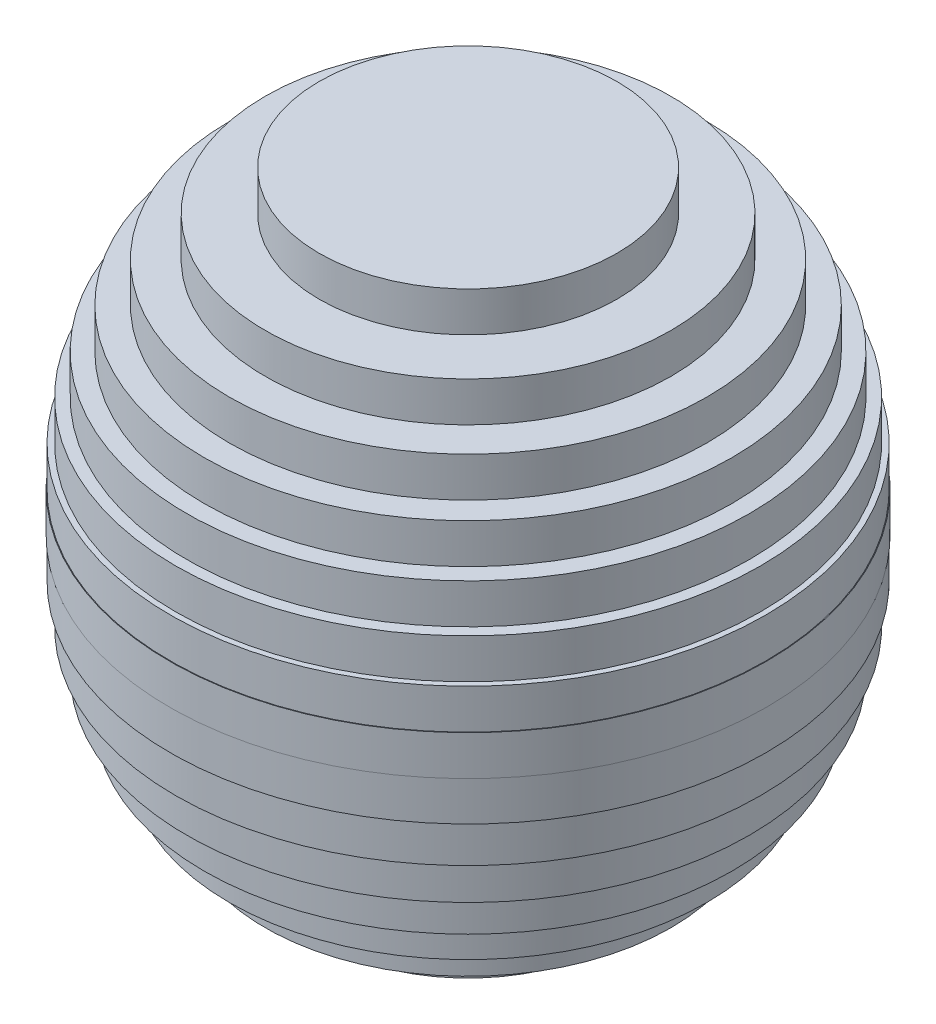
SolidWorks part; units mm, degrees
ref_plane "Front Plane" through (0, 0, 0) normal (0, 0, 1) x (1, 0, 0)
ref_plane "Top Plane" through (0, 0, 0) normal (0, 1, 0) x (1, 0, 0)
ref_plane "Right Plane" through (0, 0, 0) normal (1, 0, 0) x (0, 0, -1)
sketch "Sketch1" plane through (0, 0, 0) normal (0, 0, 1) x (1, 0, 0)
  line L0 (0, -37.5) -> (0, 37.5) construction
  line L1 (0, -37.5) -> (37.5, -37.5) construction
  line L2 (0, -32.5) -> (37.5, -32.5) construction
  line L3 (0, -27.5) -> (37.5, -27.5) construction
  line L4 (0, -22.5) -> (37.5, -22.5) construction
  line L5 (0, -17.5) -> (37.5, -17.5) construction
  line L6 (0, -12.5) -> (37.5, -12.5) construction
  line L7 (0, -7.5) -> (37.5, -7.5) construction
  line L35 (0, -2.5) -> (37.5, -2.5) construction
  line L36 (0, 2.5) -> (37.5, 2.5) construction
  line L37 (0, 7.5) -> (37.5, 7.5) construction
  line L38 (0, 12.5) -> (37.5, 12.5) construction
  line L39 (0, 17.5) -> (37.5, 17.5) construction
  line L40 (0, 22.5) -> (37.5, 22.5) construction
  line L41 (0, 27.5) -> (37.5, 27.5) construction
  line L42 (0, 32.5) -> (37.5, 32.5) construction
  arc A0 (0, 37.5) -> (0, -37.5) centre (0, 0) cw construction
  point P4 (0, 0)
  point P7 (37.5, 0)
  point P8 (0, 37.5)
sketch "Sketch3" plane through (0, 0, 0) normal (0, 0, 1) x (1, 0, 0)
  line L0 (37.5, 2.5) -> (37.5, -2.5)
  line L1 (37.5, -2.5) -> (37.4166, -2.5)
  line L2 (0, -2.5) -> (37.5, -2.5) construction
  line L3 (37.4166, -2.5) -> (37.4166, -7.5)
  line L4 (0, -7.5) -> (37.5, -7.5) construction
  line L5 (37.4166, -7.5) -> (36.7423, -7.5)
  line L6 (36.7423, -7.5) -> (36.7423, -12.5)
  line L7 (0, -12.5) -> (37.5, -12.5) construction
  line L8 (36.7423, -12.5) -> (35.3553, -12.5)
  line L9 (35.3553, -12.5) -> (35.3553, -17.5)
  line L10 (0, -17.5) -> (37.5, -17.5) construction
  line L11 (35.3553, -17.5) -> (33.1662, -17.5)
  line L12 (33.1662, -17.5) -> (33.1662, -22.5)
  line L13 (0, -22.5) -> (37.5, -22.5) construction
  line L14 (33.1662, -22.5) -> (30, -22.5)
  line L15 (30, -22.5) -> (30, -27.5)
  line L16 (0, -27.5) -> (37.5, -27.5) construction
  line L17 (30, -27.5) -> (25.4951, -27.5)
  line L18 (25.4951, -27.5) -> (25.4951, -32.5)
  line L19 (0, -32.5) -> (37.5, -32.5) construction
  line L20 (25.4951, -32.5) -> (18.7083, -32.5)
  line L21 (18.7083, -32.5) -> (18.7083, -37.5)
  line L22 (0, -37.5) -> (37.5, -37.5) construction
  line L23 (18.7083, -37.5) -> (0, -37.5)
  line L24 (0, -37.5) -> (0, 37.5)
  line L25 (18.7083, 32.5) -> (18.7083, 37.5)
  line L26 (0, 32.5) -> (37.5, 32.5) construction
  line L27 (18.7083, 37.5) -> (0, 37.5)
  line L28 (18.7083, 32.5) -> (25.4951, 32.5)
  line L29 (25.4951, 32.5) -> (25.4951, 27.5)
  line L30 (0, 27.5) -> (37.5, 27.5) construction
  line L31 (25.4951, 27.5) -> (30, 27.5)
  line L32 (30, 27.5) -> (30, 22.5)
  line L33 (0, 22.5) -> (37.5, 22.5) construction
  line L34 (30, 22.5) -> (33.1662, 22.5)
  line L35 (33.1662, 22.5) -> (33.1662, 17.5)
  line L36 (0, 17.5) -> (37.5, 17.5) construction
  line L37 (33.1662, 17.5) -> (35.3553, 17.5)
  line L38 (35.3553, 17.5) -> (35.3553, 12.5)
  line L39 (0, 12.5) -> (37.5, 12.5) construction
  line L40 (35.3553, 12.5) -> (36.7423, 12.5)
  line L41 (36.7423, 12.5) -> (36.7423, 7.5)
  line L42 (0, 7.5) -> (37.5, 7.5) construction
  line L43 (36.7423, 7.5) -> (37.4166, 7.5)
  line L44 (37.4166, 7.5) -> (37.4166, 2.5)
  line L45 (0, 2.5) -> (37.5, 2.5) construction
  line L46 (37.4166, 2.5) -> (37.5, 2.5)
  arc A0 (0, -37.5) -> (0, 37.5) centre (0, 0) ccw construction
revolve "Revolve3" add sketch "Sketch3" angle 360 about L24
equation "\"Ball Diameter\"= \"Layers\" * \"Layer Height\""
equation "\"Layers\"=15"
equation "\"D1@Sketch1\"=\"Ball Diameter\""
equation "\"Layer Height\"= 5mm"
equation "\"D3@Sketch1\"=\"Layer Height\""
equation "\"D2@Sketch1\"=\"Layers\""
